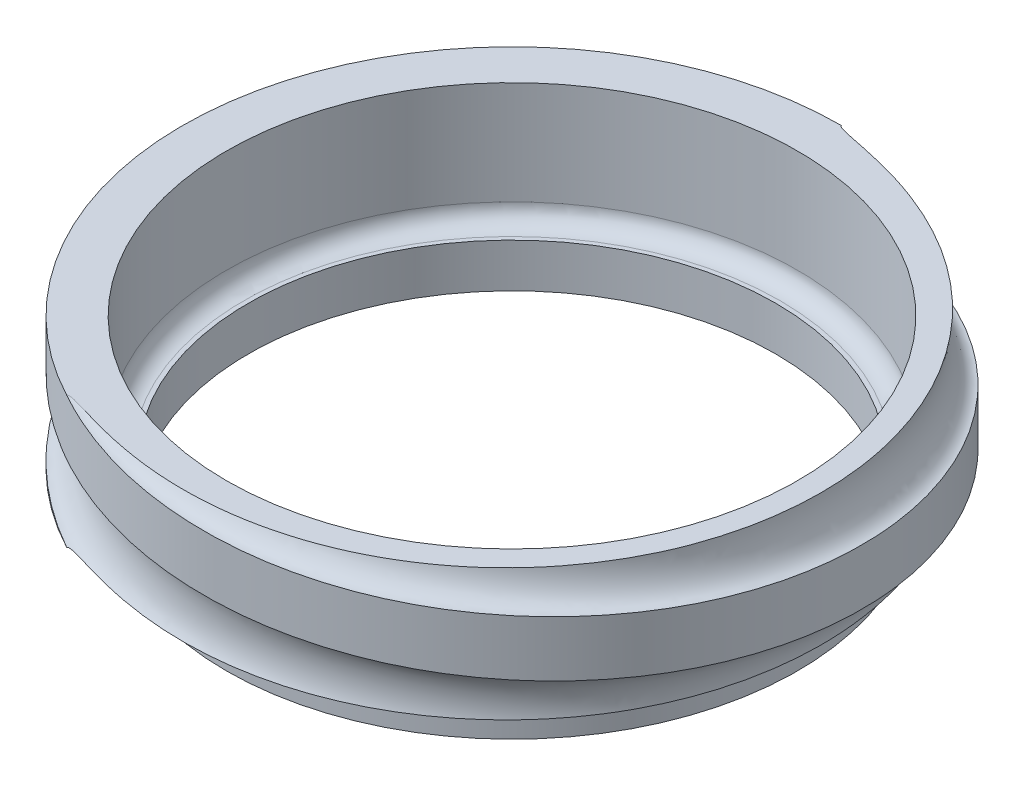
SolidWorks part; units mm, degrees
ref_plane "Front Plane" through (0, 0, 0) normal (0, 0, 1) x (1, 0, 0)
ref_plane "Top Plane" through (0, 0, 0) normal (0, 1, 0) x (1, 0, 0)
ref_plane "Right Plane" through (0, 0, 0) normal (1, 0, 0) x (0, 0, -1)
sketch "Sketch1" plane through (0, 0, 0) normal (0, 1, 0) x (1, 0, 0)
  circle A0 centre (0, 0) radius 41.275
extrude "Boss-Extrude1" add sketch "Sketch1" against normal blind 4.7625
sketch "Sketch2" plane through (0, 0, 0) normal (0, 1, 0) x (1, 0, 0)
  circle A0 centre (0, 0) radius 47.625
extrude "Boss-Extrude2" add sketch "Sketch2" along normal blind 19.05
sketch "Sketch3" plane through (0, -4.7625, 0) normal (0, -1, 0) x (1, 0, 0)
  circle A0 centre (0, 0) radius 38.1
  circle A1 centre (0, 0) radius 41.275 construction
extrude "Cut-Extrude1" cut sketch "Sketch3" against normal through all
sketch "Sketch6" plane through (0, 19.05, 0) normal (0, 1, 0) x (1, 0, 0)
  circle A0 centre (0, 0) radius 41.275
extrude "Cut-Extrude2" cut sketch "Sketch6" against normal blind 17.4625
sketch "Sketch7" plane through (0, 0, 0) normal (0, -1, 0) x (1, 0, 0)
  circle A0 centre (0, 0) radius 47.625
curve "Helix/Spiral1"
sketch "Sketch11" plane through (0, 0, 0) normal (1, 0, 0) x (0, 0, -1)
  ellipse E0 centre (47.625, -5.5) end of major axis (47.625, -11) minor radius 3.175
sweep "Cut-Sweep1" cut profiles "Sketch11" path "Helix/Spiral1"
fillet "Fillet1" radius 2.54 1 edges at (0, 1.5875, 41.275)
equation "\"inner diameter\"= 3.25"
equation "\"outer diameter\"= 3 + 5 / 8 + 1 / 8'3."
equation "\"D1@Sketch1\"=\"inner diameter\""
equation "\"inner height\"= 3 / 16"
equation "\"outer height\"= .75"
equation "\"D1@Boss-Extrude1\"=\"inner height\""
equation "\"D1@Sketch2\"=\"outer diameter\""
equation "\"D1@Boss-Extrude2\"=\"outer height\""
equation "\"shell width\"= 1 / 8"
equation "\"D1@Sketch3\"=\"shell width\""
equation "\"D1@Sketch6\"=\"inner diameter\" "
equation "\"D1@Cut-Extrude2\"=\"outer height\"-\"inner height\"+\"shell width\""
equation "\"D1@Sketch7\"=\"outer diameter\""
equation "\"D1@Sketch11\"=\"led tap width\" *1.1/2"
equation "\"D3@Helix/Spiral1\"=\"outer height\""
equation "\"led tap width\"= 1cm"
equation "\"D2@Sketch11\"=1/8"
